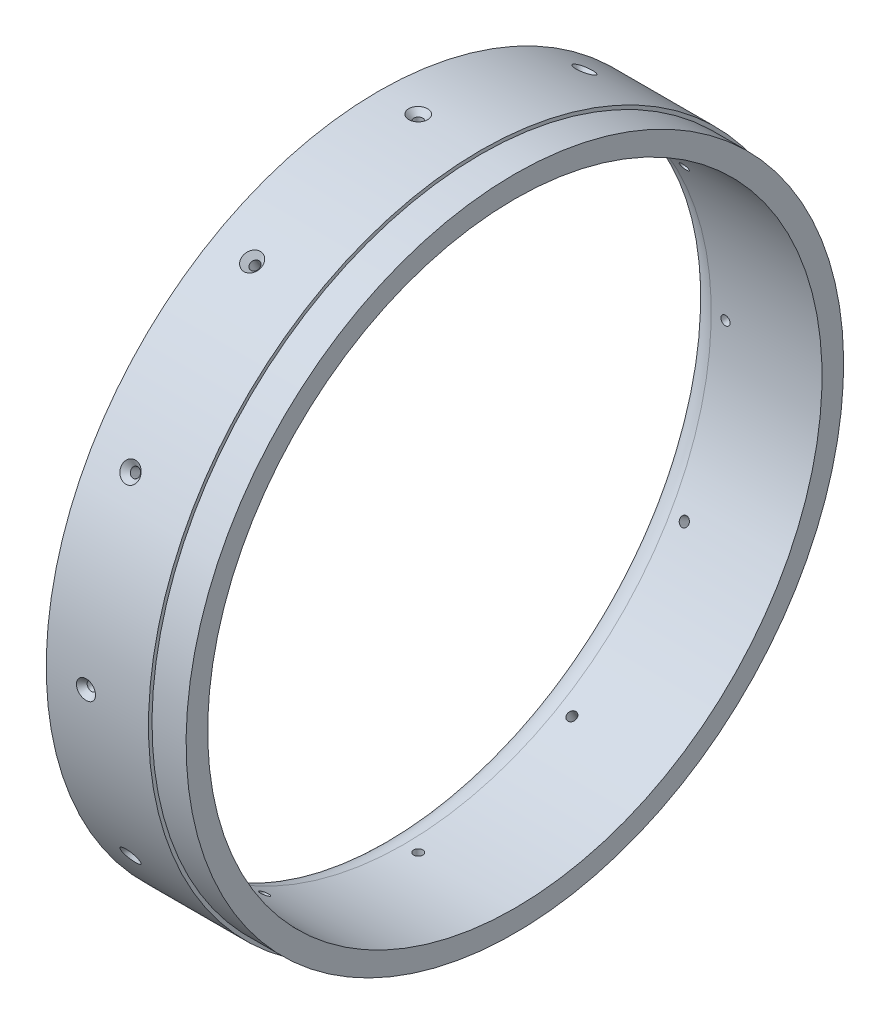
SolidWorks part; units mm, degrees
ref_plane "Front Plane" through (0, 0, 0) normal (0, 0, 1) x (1, 0, 0)
ref_plane "Top Plane" through (0, 0, 0) normal (0, 1, 0) x (1, 0, 0)
ref_plane "Right Plane" through (0, 0, 0) normal (1, 0, 0) x (0, 0, -1)
sketch "Sketch1" plane through (0, 0, 0) normal (0, 0, 1) x (1, 0, 0)
  line L1 (76.2, 171.704) -> (14.2852, 171.704)
  line L2 (57.15, 183.769) -> (76.2, 183.769)
  line L3 (57.15, 183.769) -> (57.15, 185.7375)
  line L4 (76.2, 183.769) -> (76.2, 171.704)
  line L5 (57.15, 185.7375) -> (0, 185.7375)
  line L6 (0, 0) -> (-35.5981, 0) construction
  line L7 (29.3446, -171.704) -> (14.2852, -171.704) construction
  arc A0 (0, 185.7375) -> (14.2852, 171.704) centre (14.2852, 185.9915) ccw
  dimension "D6" = 14.2875
  dimension "D11" = 0.254
  dimension "D14" = 1.9685
  dimension "D2" = 343.408
  dimension "D5" = 371.475
  dimension "D8" = 57.15
  dimension "D10" = 14.2852
  dimension "D12" = 367.538
  dimension "D15" = 19.05
revolve "Revolve1" add sketch "Sketch1" angle 360 about L6
hole_wizard "CSK for #10 Flat Head Socket Cap Screw (custom)1" positions "3DSketch2" profile "Sketch4" countersink size "#10" standard "ANSI Inch"
sketch3d "3DSketch2"
  point P0 (22.225, 185.7375, 0)
sketch "Sketch4" plane through (22.225, 185.7375, 0) normal (1, 0, 0) x (0, 0, 1)
  line L0 (0, 0) -> (0, 420.2909)
  line L1 (0, 420.2909) -> (2.5527, 420.2909)
  line L2 (2.5527, 420.2909) -> (2.5527, 3.195)
  line L3 (2.5527, 3.195) -> (5.3301, 0)
  line L5 (5.3301, 0) -> (0, 0)
  line L6 (-2.5527, 3.195) -> (-5.3301, 0) construction
  line L11 (0, -6.35) -> (0, 107.95) construction
  dimension "Thru Hole Dia." = 5.1054
  dimension "Thru Hole Depth" = 420.2909
  dimension "Near C'Sink Dia." = 10.6602
  dimension "Near C'Sink Angle" = 82
pattern_circular "CirPattern1" count 12 over 360 about axis through (0, 0, 0) along (1, 0, 0) of "CSK for #10 Flat Head Socket Cap Screw (custom)1"
sketch3d "CenterOfMass 12/09/2008 10:37:52"
  point P0 (53.973, 0, 0)
sketch "Sketch5" plane through (0, 0, 0) normal (1, 0, 0) x (0, 0, -1)
  line L0 (-177.3237, 0) -> (0, 0) construction
  line L5 (172.2865, 28.575) -> (-172.2865, 28.575)
  line L7 (172.2865, -28.575) -> (-172.2865, -28.575)
  line L9 (0, 19.8734) -> (0, 0) construction
  circle A0 centre (0, 0) radius 177.3237 construction
  arc A1 (-175.4275, 25.8631) -> (-175.4275, -25.8631) centre (0, 0) ccw
  arc A2 (175.4275, -25.8631) -> (175.4275, 25.8631) centre (0, 0) ccw
  arc A3 (172.2865, -28.575) -> (175.4275, -25.8631) centre (172.2865, -25.4) ccw
  arc A4 (172.2865, 28.575) -> (175.4275, 25.8631) centre (172.2865, 25.4) cw
  arc A5 (-172.2865, -28.575) -> (-175.4275, -25.8631) centre (-172.2865, -25.4) cw
  arc A6 (-172.2865, 28.575) -> (-175.4275, 25.8631) centre (-172.2865, 25.4) ccw
  point P6 (175.0062, -28.575)
  dimension "D1" = 3.175
  dimension "D2" = 57.15
extrude "FlowSlotCut" [suppressed] cut sketch "Sketch5" along normal through all
sketch "Sketch6" plane through (0, 0, 0) normal (1, 0, 0) x (0, 0, -1)
  line L0 (0, 88.199) -> (0, 0) construction
  line L1 (0, 88.199) -> (0, 147.955) construction
  line L2 (28.575, 144.6107) -> (84.9867, 88.199)
  line L3 (84.9867, 88.199) -> (-84.9867, 88.199)
  line L4 (-28.575, 144.6107) -> (-84.9867, 88.199)
  circle A0 centre (0, 0) radius 147.955 construction
  arc A1 (26.9073, 145.4877) -> (-26.9073, 145.4877) centre (0, 0) ccw
  arc A2 (28.575, 144.6107) -> (26.9073, 145.4877) centre (26.3299, 142.3657) ccw
  arc A3 (-28.575, 144.6107) -> (-26.9073, 145.4877) centre (-26.3299, 142.3657) cw
  dimension "D2" = 3.175
  dimension "D1" = 90
  dimension "D3" = 57.15
extrude "Top Cut" [suppressed] cut sketch "Sketch6" along normal through all
sketch "Sketch7" plane through (0, 0, 0) normal (1, 0, 0) x (0, 0, -1)
  line L0 (0, -51.436) -> (0, 0) construction
  line L1 (46.0375, -51.436) -> (-46.0375, -51.436)
  line L2 (46.0375, -51.436) -> (46.0375, -138.2897)
  line L4 (-46.0375, -51.436) -> (-46.0375, -138.2897)
  circle A0 centre (0, 0) radius 147.955 construction
  arc A1 (-43.8025, -141.3224) -> (43.8025, -141.3224) centre (0, 0) ccw
  arc A2 (46.0375, -138.2897) -> (43.8025, -141.3224) centre (42.8625, -138.2897) cw
  arc A3 (-46.0375, -138.2897) -> (-43.8025, -141.3224) centre (-42.8625, -138.2897) ccw
  dimension "D2" = 3.175
  dimension "D1" = 92.075
extrude "Puck-Pathfinder Cut" [suppressed] cut sketch "Sketch7" along normal through all
sketch "Sketch8" plane through (0, 0, 0) normal (1, 0, 0) x (0, 0, -1)
  line L0 (-68.3664, 98.8129) -> (-109.1834, 50.1691)
  line L1 (-88.7749, 74.491) -> (0, 0) construction
  line L2 (0, 0) -> (0, 107.6911) construction
  line L3 (-68.3664, 98.8129) -> (-88.3178, 115.5541)
  line L4 (-109.1834, 50.1691) -> (-129.1348, 66.9103)
  arc A0 (-129.1348, 66.9103) -> (-129.8811, 70.8631) centre (-127.0939, 69.3425) cw
  arc A1 (-88.3178, 115.5541) -> (-92.3402, 115.6027) centre (-90.3586, 113.1219) ccw
  circle A2 centre (0, 0) radius 147.955 construction
  arc A3 (-92.3402, 115.6027) -> (-129.8811, 70.8631) centre (0, 0) ccw
  dimension "D2" = 3.175
  dimension "D1" = 50
  dimension "D3" = 115.8874
  dimension "D5" = 63.5
extrude "SeaBird Pump Cut" [suppressed] cut sketch "Sketch8" along normal through all
sketch "Sketch9" plane through (0, 0, 0) normal (1, 0, 0) x (0, 0, -1)
  circle A0 centre (0, 0) radius 147.955
extrude "514-18, Rev.F  Cut-Extrude1" [suppressed] cut sketch "Sketch9" along normal through all
equation "\"Buoyancy\"=\"SW-Volume\"*(\"SW-Density\"-.037062)"
equation "\"Air Weight\"= \"SW-Mass\""
